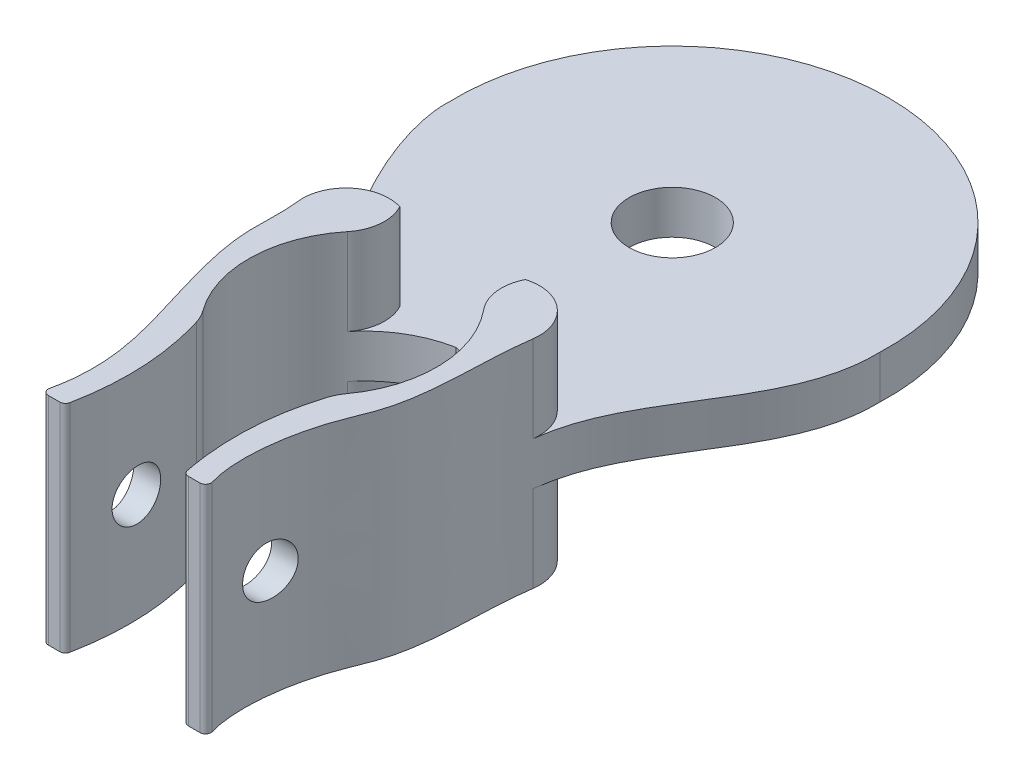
SolidWorks part; units mm, degrees
ref_plane "Front Plane" through (0, 0, 0) normal (0, 0, 1) x (1, 0, 0)
ref_plane "Top Plane" through (0, 0, 0) normal (0, 1, 0) x (1, 0, 0)
ref_plane "Right Plane" through (0, 0, 0) normal (1, 0, 0) x (0, 0, -1)
sketch "Sketch1" plane through (0, 0, 0) normal (0, 1, 0) x (1, 0, 0)
  line L0 (0, 12.7) -> (0, -18.5764) construction
  line L1 (-4.4511, -32.1986) -> (-3.776, -32.1986)
  line L2 (4.4511, -32.1986) -> (3.776, -32.1986)
  arc A0 (-12.6901, -0.502) -> (12.6901, -0.502) centre (0, 0) cw
  circle A1 centre (0, 0) radius 2.54
  arc A2 (-12.6901, -0.502) -> (12.6901, -0.502) centre (0, 0) ccw construction
  arc A3 (0, -12.7) -> (-4.2124, -23.3606) centre (1.256, -19.3588) ccw
  arc A4 (-4.2124, -23.3606) -> (-3.8349, -24.1124) centre (-6.2622, -24.8607) cw
  arc A5 (-3.4519, -31.9324) -> (-3.776, -32.1986) centre (-3.776, -31.8683) cw
  arc A6 (-4.7735, -31.7962) -> (-4.4511, -32.1986) centre (-4.4511, -31.8683) ccw
  arc A7 (4.7735, -31.7962) -> (4.4511, -32.1986) centre (4.4511, -31.8683) cw
  arc A8 (3.4519, -31.9324) -> (3.776, -32.1986) centre (3.776, -31.8683) ccw
  arc A9 (4.2124, -23.3606) -> (3.8349, -24.1124) centre (6.2622, -24.8607) ccw
  arc A10 (0, -12.7) -> (4.2124, -23.3606) centre (-1.256, -19.3588) cw
  spline S0 degree 3 poles (-12.6901, -0.502) (-12.7086, -0.5346) (-12.9445, -3.8187) (-6.4425, -13.8865) (-7.3603, -18.4592) (-5.2739, -24.7591) (-4.156, -29.0329) (-4.7735, -31.7962) knots 0 0 0 0 0.279659 0.433864 0.566787 0.759909 0.988954 0.988954 0.988954 0.988954
  spline S1 degree 3 poles (-3.8349, -24.1124) (-3.6668, -24.6575) (-3.0286, -27.202) (-3.0384, -29.8419) (-3.4519, -31.9324) knots 0.055076 0.055076 0.055076 0.055076 0.252507 0.96957 0.96957 0.96957 0.96957
  spline S2 degree 3 poles (3.8349, -24.1124) (3.6668, -24.6575) (3.0286, -27.202) (3.0384, -29.8419) (3.4519, -31.9324) knots 0.055076 0.055076 0.055076 0.055076 0.252507 0.96957 0.96957 0.96957 0.96957
  spline S3 degree 3 poles (12.6901, -0.502) (12.8342, -5.638) (5.4885, -11.2875) (7.0856, -20.9954) (4.5252, -26.6602) (4.2626, -30.148) (4.7735, -31.7962) knots 0 0 0 0 0.420411 0.703009 0.760968 1 1 1 1
  dimension "D1" = 12.7
  dimension "D2" = 5.08
  dimension "D3" = 2.54
  dimension "D4" = 0.3304
extrude "Boss-Extrude1" add sketch "Sketch1" along normal blind 12.7
ref_plane "Plane1" through (0, 5.08, 0) normal (0, 1, 0) x (1, 0, 0)
sketch "Sketch4" plane through (0, 5.08, 0) normal (0, 1, 0) x (1, 0, 0)
  circle A0 centre (0, 0) radius 12.827
  dimension "D1" = 25.654
extrude "Cut-Extrude4" cut sketch "Sketch4" against normal blind 10.16
ref_plane "Plane2" through (0, 7.62, 0) normal (0, 1, 0) x (1, 0, 0)
sketch "Sketch5" plane through (0, 7.62, 0) normal (0, 1, 0) x (1, 0, 0)
  circle A0 centre (0, 0) radius 12.827
  dimension "D1" = 25.654
extrude "Cut-Extrude5" cut sketch "Sketch5" along normal blind 10.16
fillet "Fillet3" radius 2.54 4 edges at (-10.2825, 2.54, 7.6682) (9.9596, 2.54, 8.0832) (-10.2825, 10.16, 7.6682) (9.9596, 10.16, 8.0832)
fillet "Fillet4" radius 2.54 4 edges at (-0.5103, 2.54, 12.8168) (0.5103, 2.54, 12.8168) (0.5103, 10.16, 12.8168) (-0.5103, 10.16, 12.8168)
ref_plane "Plane3" through (7.62, 0, 0) normal (1, 0, 0) x (0, 0, -1)
hole_wizard "#4 Clearance Hole2" positions "Sketch10" profile "Sketch9" hole size "#4" standard "ANSI Inch"
sketch "Sketch10" plane through (7.62, 0, 0) normal (1, 0, 0) x (0, 0, -1)
  point P0 (-28.2663, 6.3387)
sketch "Sketch9" plane through (7.62, 6.3387, 28.2663) normal (0, 1, 0) x (0, 0, -1)
  line L0 (0, 0) -> (0, 20.5645)
  line L1 (0, 20.5645) -> (1.4732, 20.5645)
  line L2 (1.4732, 20.5645) -> (1.4732, 0)
  line L5 (1.4732, 0) -> (0, 0)
  line L11 (0, -6.35) -> (0, 107.95) construction
  dimension "Thru Hole Dia." = 2.9464
  dimension "Thru Hole Depth" = 20.5645
